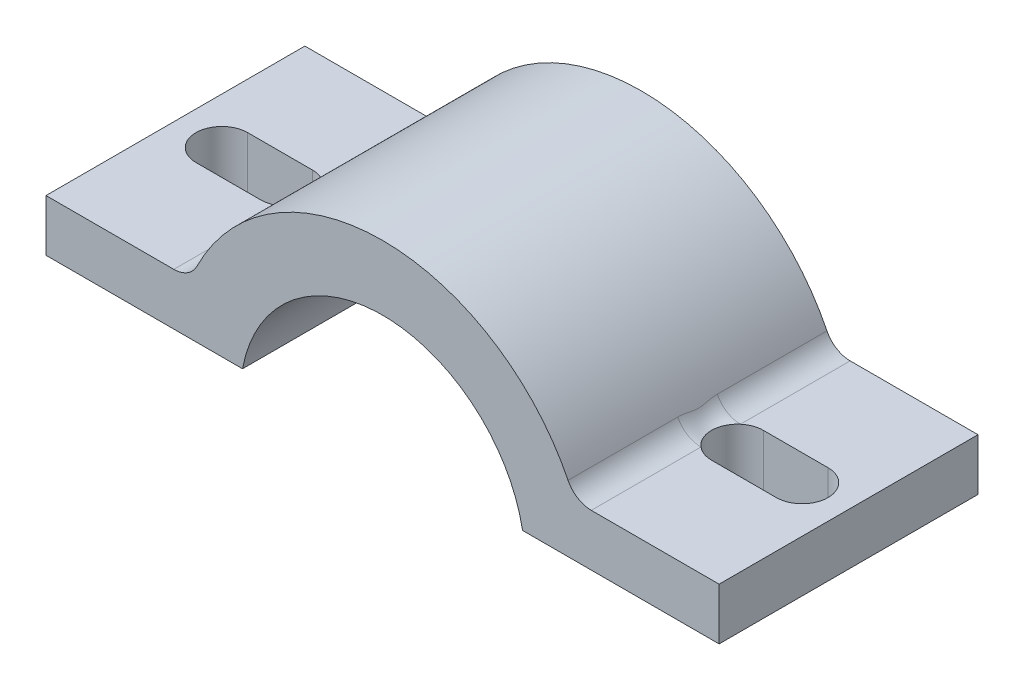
SolidWorks part; units mm, degrees
ref_plane "Front Plane" through (0, 0, 0) normal (0, 0, 1) x (1, 0, 0)
ref_plane "Top Plane" through (0, 0, 0) normal (0, 1, 0) x (1, 0, 0)
ref_plane "Right Plane" through (0, 0, 0) normal (1, 0, 0) x (0, 0, -1)
sketch "Sketch1" plane through (0, 0, 0) normal (0, 0, 1) x (1, 0, 0)
  line L0 (16, 0) -> (26, 0)
  line L1 (26, 6) -> (14.8324, 6)
  line L2 (26, 0) -> (26, 6)
  line L3 (-16, 0) -> (-26, 0)
  line L4 (-26, 0) -> (-26, 6)
  line L5 (-26, 6) -> (-14.8324, 6)
  line L6 (-16, 0) -> (16, 0)
  circle A0 centre (0, 0) radius 16
  circle A1 centre (0, 0) radius 11
  point P13 (-20.4162, 6)
  dimension "D1" = 32
  dimension "D6" = 22
  dimension "D2" = 10
  dimension "D3" = 10
  dimension "D4" = 6
  dimension "D5" = 6
extrude "Boss-Extrude1" add sketch "Sketch1" along normal blind 20 contours A0 L5 L4 L3 | A1 L6 A0 | A0 L0 L2 L1
sketch "Sketch2" plane through (0, 6, 0) normal (0, 1, 0) x (1, 0, 0)
  line L0 (-20.4162, -10) -> (-14.8324, -10)
  line L1 (26, -10) -> (14.8324, -10)
  line L2 (26, -20) -> (26, 0) construction
  line L3 (14.8324, -20) -> (14.8324, 0) construction
  line L4 (17.4162, -8) -> (21.746, -8)
  line L5 (17.4162, -12) -> (21.746, -12)
  line L6 (-20.4162, -10) -> (-26, -10)
  line L7 (-26, -20) -> (-26, 0) construction
  line L8 (-14.8324, -20) -> (-14.8324, 0) construction
  line L9 (0, 0) -> (0, -20)
  line L10 (-14.8324, -20) -> (14.8324, -20) construction
  line L11 (-17.4162, -12) -> (-21.746, -12)
  line L12 (-17.4162, -8) -> (-21.746, -8)
  line L13 (21.746, -8) -> (22.4162, -8)
  line L14 (22.4162, -12) -> (21.746, -12)
  line L15 (-21.746, -8) -> (-22.4162, -8)
  line L16 (-21.746, -12) -> (-22.4162, -12)
  circle A2 centre (17.4162, -10) radius 2
  circle A3 centre (22.4162, -10) radius 2
  circle A4 centre (-17.4162, -10) radius 2
  circle A5 centre (-22.4162, -10) radius 2
  point P18 (20.4162, -10)
  dimension "D2" = 4
  dimension "D3" = 4
  dimension "D4" = 3
  dimension "D5" = 2
  dimension "D6" = 5.5838
  dimension "D7" = 5.5838
extrude "Cut-Extrude4" cut sketch "Sketch2" against normal through all contours L15 A5 L0 A4 L12 | A4 L0 | A4 L0 | L0 A5 L16 L11 A4 | A5 L6 | A5 L6 | L1 A2 | A2 L1 | A3 L13 L4 A2 L1 | A3 L1 A2 L5 L14 | L1 A3 | A3 L1
fillet "Fillet1" radius 2 2 edges at (-14.8324, 6, 10) (14.8324, 6, 10)
sketch "Sketch3" plane through (0, 0, 20) normal (0, 0, 1) x (1, 0, 0)
  line L0 (26, 0) -> (26, 6) construction
  line L1 (-26, 0) -> (26, 0)
  line L2 (-26, 0) -> (-26, 2)
  line L3 (-26, 2) -> (26, 2)
  line L4 (26, 0) -> (26, 2)
  dimension "D1" = 2
extrude "Cut-Extrude2" cut sketch "Sketch3" against normal through all
